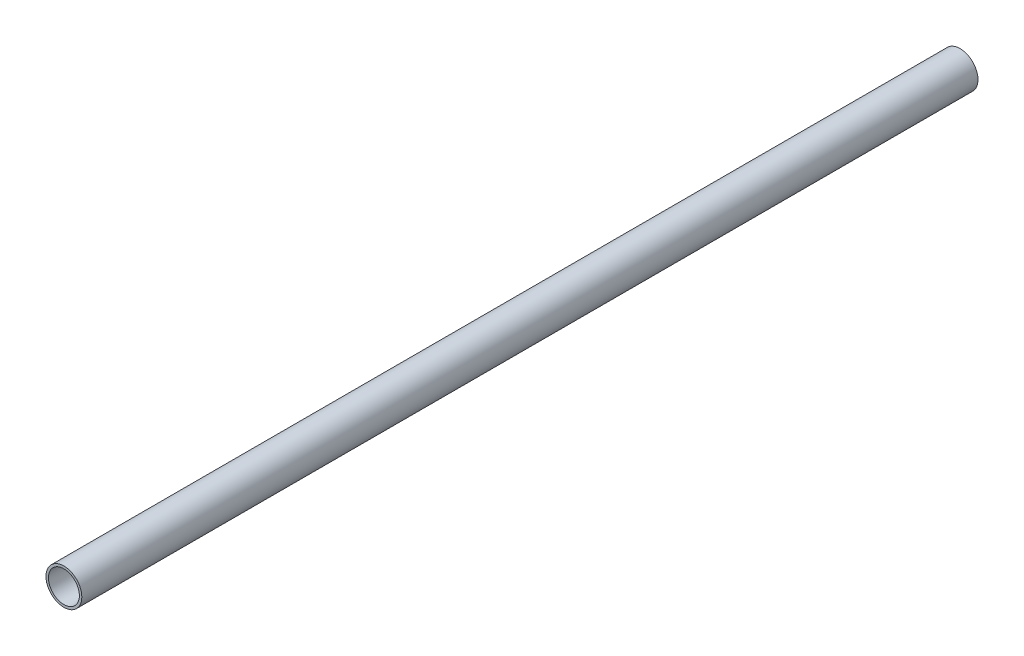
SolidWorks part; units mm, degrees
ref_plane "Alzado" through (0, 0, 0) normal (0, 0, 1) x (1, 0, 0)
ref_plane "Planta" through (0, 0, 0) normal (0, 1, 0) x (1, 0, 0)
ref_plane "Vista lateral" through (0, 0, 0) normal (1, 0, 0) x (0, 0, -1)
sketch "Croquis1" plane through (0, 0, 0) normal (0, 0, 1) x (1, 0, 0)
  circle A0 centre (0, 0) radius 11
  circle A1 centre (0, 0) radius 9.5
  dimension "D1" = 19
  dimension "D2" = 22
extrude "Saliente-Extruir1" add sketch "Croquis1" along normal blind 550
